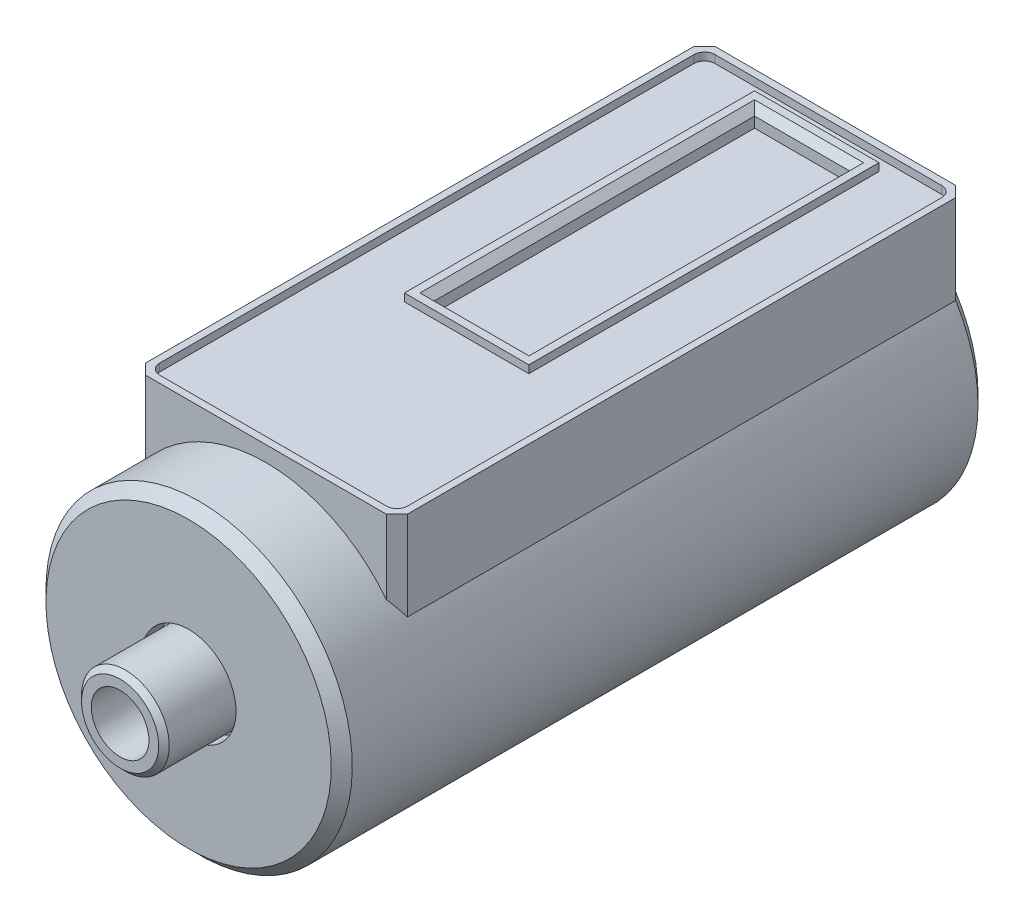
SolidWorks part; units mm, degrees
ref_plane "Front" through (0, 0, 0) normal (0, 0, 1) x (1, 0, 0)
ref_plane "Top" through (0, 0, 0) normal (0, 1, 0) x (1, 0, 0)
ref_plane "Right" through (0, 0, 0) normal (1, 0, 0) x (0, 0, -1)
sketch "Sketch2" plane through (0, 0, 0) normal (1, 0, 0) x (0, 0, -1)
  line L0 (59.435, 0) -> (59.435, 2.79)
  line L1 (59.815, 3.17) -> (65.655, 3.17)
  line L2 (64.385, 3.43) -> (64.385, 10.31)
  line L3 (65.145, 11.07) -> (111.125, 11.07)
  line L4 (111.125, 11.07) -> (111.125, 0)
  line L5 (111.125, 0) -> (59.435, 0)
  line L6 (64.385, 3.43) -> (65.655, 3.43)
  line L7 (65.655, 3.43) -> (65.655, 3.17)
  line L8 (59.435, 2.79) -> (59.815, 3.17)
  line L9 (64.385, 10.31) -> (65.145, 11.07)
  dimension "D1" = 51.69
  dimension "D2" = 3.17
  dimension "D3" = 11.07
  dimension "D4" = 4.95
  dimension "D5" = 1.27
  dimension "D6" = 3.43
  dimension "D7" = 2.79
  dimension "D8" = 0.38
  dimension "D9" = 0.76
  dimension "D10" = 10.31
  dimension "D11" = 111.125
revolve "Revolve1" add sketch "Sketch2" angle 360 about L5
sketch "Sketch3" plane through (0, 0, 0) normal (0, 1, 0) x (1, 0, 0)
  line L0 (11.07, 111.125) -> (-11.07, 111.125) construction
  line L1 (-9.46, 111.125) -> (9.46, 111.125)
  line L2 (-9.46, 111.125) -> (-9.46, 70.735)
  line L3 (-8.7, 69.975) -> (8.7, 69.975)
  line L4 (9.46, 111.125) -> (9.46, 70.735)
  line L5 (-9.46, 70.735) -> (-8.7, 69.975)
  line L6 (9.46, 70.735) -> (8.7, 69.975)
  point P1 (9.46, 69.975)
  point P2 (-9.46, 69.975)
  point P6 (0, 69.975)
  dimension "D1" = 41.15
  dimension "D2" = 18.92
extrude "Extrude1" add sketch "Sketch3" along normal blind 12.19
chamfer "Chamfer1" distance 0.76 angle 45 3 edges at (-9.46, 8.9696, -111.125) (0, -11.07, -111.125) (9.46, 8.9696, -111.125)
sketch "Sketch4" plane through (0, 12.19, 0) normal (0, 1, 0) x (1, 0, 0)
  line L0 (-8.7, 69.975) -> (8.7, 69.975) construction
  line L1 (-8.19, 110.615) -> (8.2, 110.615)
  line L2 (-8.95, 109.855) -> (-8.95, 71.245)
  line L3 (-8.19, 70.485) -> (8.2, 70.485)
  line L4 (8.96, 109.855) -> (8.96, 71.245)
  line L5 (-9.46, 70.735) -> (-9.46, 110.365) construction
  line L7 (-4.49, 109.775) -> (4.5, 109.775)
  line L8 (-4.49, 109.775) -> (-4.49, 84.475)
  line L9 (-4.49, 84.475) -> (4.5, 84.475)
  line L10 (4.5, 109.775) -> (4.5, 84.475)
  arc A0 (-8.95, 109.855) -> (-8.19, 110.615) centre (-8.19, 109.855) cw
  arc A1 (8.96, 109.855) -> (8.2, 110.615) centre (8.2, 109.855) ccw
  arc A2 (8.96, 71.245) -> (8.2, 70.485) centre (8.2, 71.245) cw
  arc A3 (-8.95, 71.245) -> (-8.19, 70.485) centre (-8.19, 71.245) ccw
  dimension "D5" = 0.76
  dimension "D1" = 17.91
  dimension "D2" = 40.13
  dimension "D3" = 0.51
  dimension "D4" = 0.51
  dimension "D6" = 0.84
  dimension "D7" = 4.46
  dimension "D8" = 4.46
  dimension "D9" = 25.3
extrude "Cut-Extrude1" cut sketch "Sketch4" against normal blind 0.56
sketch "Sketch5" plane through (0, 12.19, 0) normal (0, 1, 0) x (1, 0, 0)
  line L1 (-3.42, 108.705) -> (3.44, 108.705)
  line L2 (-3.42, 108.705) -> (-3.42, 85.545)
  line L3 (-3.42, 85.545) -> (3.44, 85.545)
  line L4 (3.44, 108.705) -> (3.44, 85.545)
  line L6 (4.5, 109.775) -> (-4.49, 109.775) construction
  line L7 (-4.49, 109.775) -> (-4.49, 84.475) construction
  point P4 (0.005, 109.775)
  dimension "D1" = 6.86
  dimension "D2" = 23.16
  dimension "D3" = 1.07
  dimension "D4" = 1.07
extrude "Cut-Extrude2" cut sketch "Sketch5" against normal blind 1.27
chamfer "Chamfer2" distance 0.51 angle 45 4 edges at (0.01, 12.19, -85.545) (3.44, 12.19, -97.125) (-3.42, 12.19, -97.125) (0.01, 12.19, -108.705)
hole_wizard "Hole1" positions "Sketch7" profile "Sketch6" legacy
sketch "Sketch7" plane through (0, 0, -59.435) normal (0, 0, 1) x (1, 0, 0)
  circle A0 centre (0, 0) radius 3.17 construction
  point P0 (0, 0)
sketch "Sketch6" plane through (0, 0, -59.435) normal (1, 0, 0) x (0, -1, 0)
  line L0 (0, 0) -> (0, 7.6015)
  line L1 (0, 7.6015) -> (2.0828, 6.35)
  line L2 (2.0828, 6.35) -> (2.0828, 0)
  line L4 (2.0828, 0) -> (0, 0)
  line L6 (0, 7.6015) -> (-2.0828, 6.35) construction
  line L7 (0, -4.2442) -> (0, 117.3081) construction
  dimension "Diameter" = 4.1656
  dimension "Depth" = 6.35
  dimension "Drill Angle" = 118
